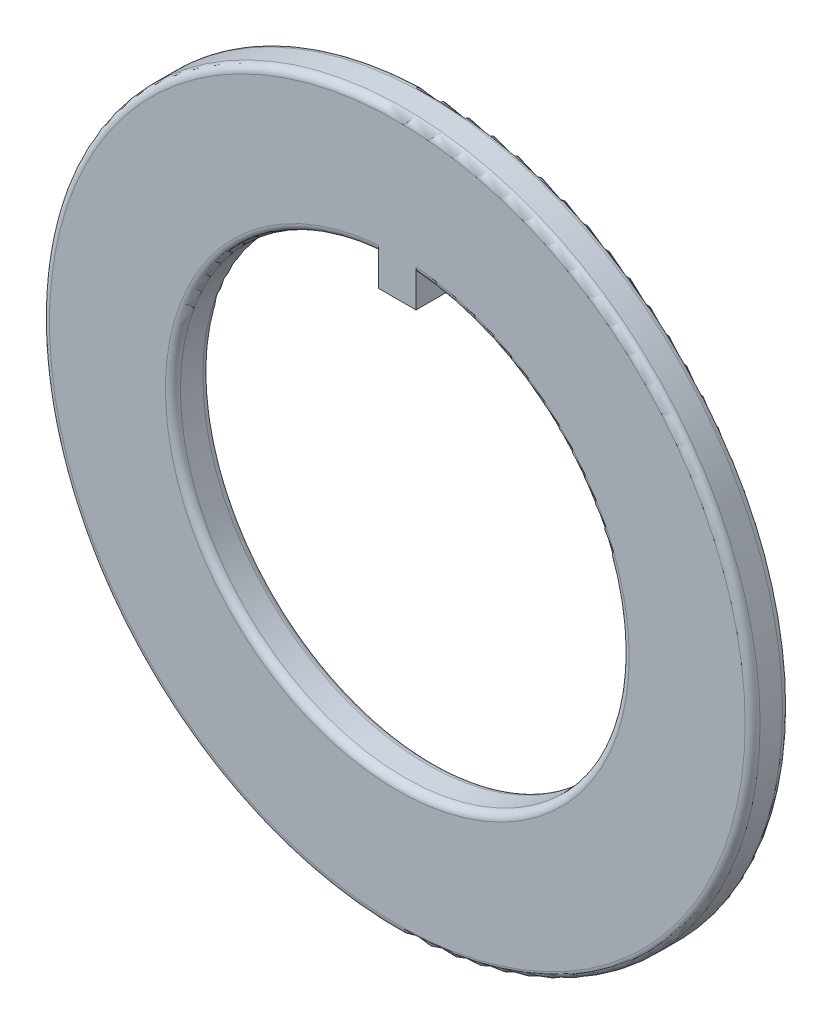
SolidWorks part; units mm, degrees
ref_plane "Plan de face" through (0, 0, 0) normal (0, 0, 1) x (1, 0, 0)
ref_plane "Plan de dessus" through (0, 0, 0) normal (0, 1, 0) x (1, 0, 0)
ref_plane "Plan de droite" through (0, 0, 0) normal (1, 0, 0) x (0, 0, -1)
sketch "Esquisse1" plane through (0, 0, 0) normal (0, 0, 1) x (1, 0, 0)
  line L0 (-10.9331, 0) -> (11.8636, 0) construction
  line L1 (0, -12.4326) -> (0, 10.8284) construction
  line L2 (-0.5, 5.9791) -> (-0.5, 5.1791)
  line L3 (-0.5, 5.1791) -> (0.5, 5.1791)
  line L4 (0.5, 5.1791) -> (0.5, 5.9791)
  arc A0 (-0.5, 5.9791) -> (0.5, 5.9791) centre (0, 0) ccw
  circle A1 centre (0, 0) radius 9.5
  dimension "D1" = 6
  dimension "D2" = 19
  dimension "D3" = 0.5
  dimension "D4" = 1
  dimension "D5" = 0.8
extrude "Boss.-Extru.1" add sketch "Esquisse1" along normal blind 1
fillet "Congé1" radius 0.2 4 edges at (0, -6, 0) (9.5, 0, 0) (0, -6, 1) (9.5, 0, 1)
